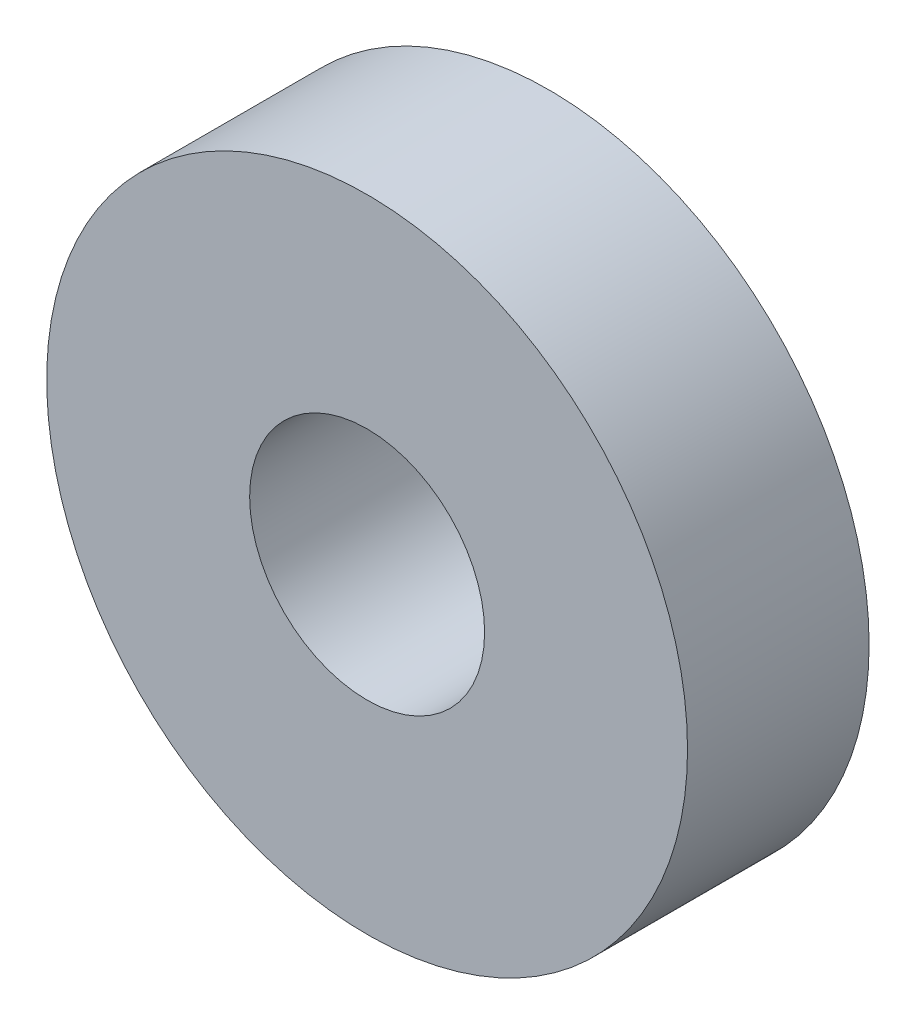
SolidWorks part; units mm, degrees
ref_plane "Plan de face" through (0, 0, 0) normal (0, 0, 1) x (1, 0, 0)
ref_plane "Plan de dessus" through (0, 0, 0) normal (0, 1, 0) x (1, 0, 0)
ref_plane "Plan de droite" through (0, 0, 0) normal (1, 0, 0) x (0, 0, -1)
sketch "Esquisse1" plane through (0, 0, 0) normal (0, 0, 1) x (1, 0, 0)
  circle A0 centre (0, 0) radius 3
  circle A1 centre (0, 0) radius 1.1
  dimension "D1" = 2.2
  dimension "D2" = 6
extrude "Extrusion1" add sketch "Esquisse1" along normal blind 1.7
